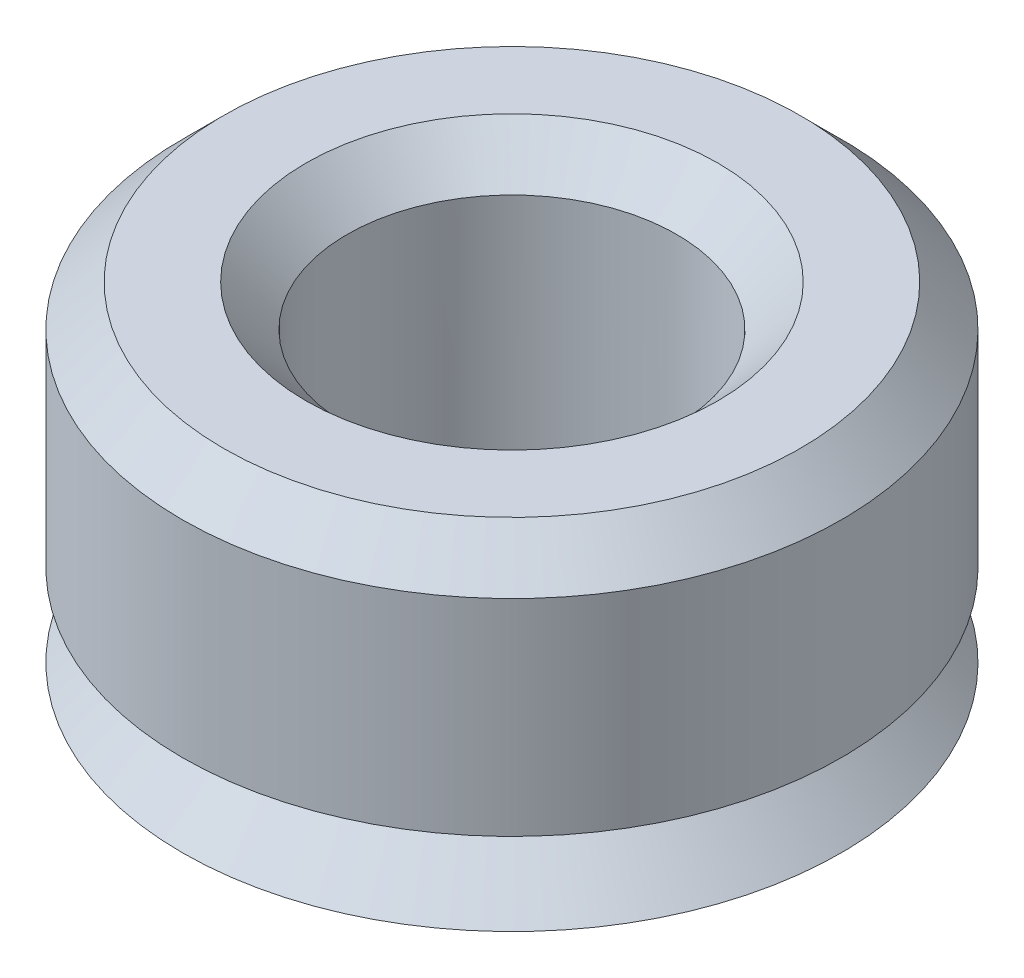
SolidWorks part; units mm, degrees
ref_plane "Front Plane" through (0, 0, 0) normal (0, 0, 1) x (1, 0, 0)
ref_plane "Top Plane" through (0, 0, 0) normal (0, 1, 0) x (1, 0, 0)
ref_plane "Right Plane" through (0, 0, 0) normal (1, 0, 0) x (0, 0, -1)
sketch "Sketch1" plane through (0, 0, 0) normal (1, 0, 0) x (0, 0, -1)
  line L0 (0, 0) -> (0, -33.6827) construction
  line L1 (-2, 0) -> (-2, 4)
  line L2 (-2, 0) -> (-4, 0)
  line L3 (-4, 0) -> (-3, 1)
  line L5 (-3, 1) -> (-4, 1)
  line L6 (-4, 1) -> (-4, 4)
  line L7 (-4, 4) -> (-2, 4)
  dimension "D1" = 4
  dimension "D2" = 45
  dimension "D3" = 1
  dimension "D4" = 8
  dimension "D5" = 6
  dimension "D6" = 3
revolve "Revolve1" add sketch "Sketch1" angle 360 about L0
chamfer "Chamfer1" distance 0.5 angle 45 3 edges at (0, 0, 2) (0, 4, 2) (0, 4, 4)
